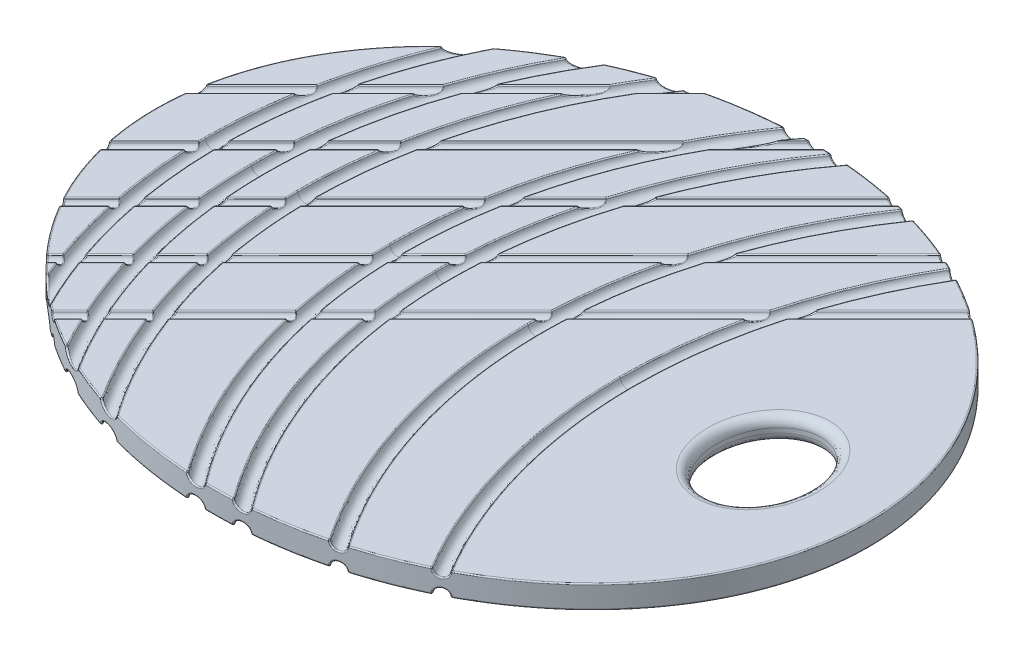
SolidWorks part; units mm, degrees
ref_plane "Front Plane" through (0, 0, 0) normal (0, 0, 1) x (1, 0, 0)
ref_plane "Top Plane" through (0, 0, 0) normal (0, 1, 0) x (1, 0, 0)
ref_plane "Right Plane" through (0, 0, 0) normal (1, 0, 0) x (0, 0, -1)
sketch "Sketch1" plane through (0, 0, 0) normal (0, 1, 0) x (1, 0, 0)
  line L0 (-77.5, 0) -> (77.5, 0) construction
  ellipse E0 centre (0, 0) end of major axis (77.5, 0) minor radius 65
  ellipse E1 centre (54.5, 0) end of major axis (54.5, -12.5) minor radius 10
  point P10 (0, 0)
  dimension "D1" = 155
  dimension "D2" = 130
  dimension "D3" = 25
  dimension "D4" = 20
  dimension "D5" = 13
extrude "Boss-Extrude1" add sketch "Sketch1" along normal blind 2.5 contours L0 E0 E1 | E0 L0 E1
sketch "Sketch4" plane through (0, 2.5, 0) normal (0, 1, 0) x (1, 0, 0)
  line L0 (-35, 75) -> (-35, -75) construction
  line L1 (0, 0) -> (-35, 0) construction
  arc A0 (-35, 75) -> (-35, -75) centre (43.75, 0) ccw
  point P6 (-65, 0)
  dimension "D1" = 35
  dimension "D3" = 30
  dimension "D2" = 150
sketch "Sketch3" plane through (0, 0, 0) normal (0, 0, 1) x (1, 0, 0)
  circle A0 centre (-65, 2.5) radius 1.5
  point P0 (0, 0)
  dimension "D1" = 3
sweep "Cut-Sweep1" cut profiles "Sketch3" path "Sketch4"
mirror "Mirror1" about plane through (0, 0, 0) normal (0, 0, 1) of "Cut-Sweep1"
sketch "Sketch5" plane through (0, 2.5, 0) normal (0, 1, 0) x (1, 0, 0)
  line L0 (-48.4084, 0) -> (95.7734, 0) construction
  line L1 (0, 0) -> (62.7975, 62.7975) construction
  line L2 (92.3498, -64.0656) -> (-46.9591, 75.2433) construction
  point P5 (-51.3269, 70.8754)
  point P8 (94.0535, -62.3619)
  dimension "D1" = 45
  dimension "D2" = 20
pattern_linear "LPattern1" count 10 spacing 10 along (1, 0, 0) of "Mirror1", "Cut-Sweep1"
fillet "Fillet1" [suppressed] radius 1
ref_plane "Plane1" through (62.7975, 2.5, -62.7975) normal (0.7071, 0, -0.7071) x (-0.7071, 0, -0.7071)
sketch "Sketch6" plane through (62.7975, 2.5, -62.7975) normal (0.7071, 0, -0.7071) x (-0.7071, 0, -0.7071)
  line L0 (34.2299, 0) -> (-67.722, 0) construction
  circle A0 centre (0, 0) radius 1
  dimension "D1" = 2
extrude "Cut-Extrude1" cut sketch "Sketch6" against normal through all
pattern_linear "LPattern2" count 5 spacing 15 along (-0.7071, 0, -0.7071) of "Cut-Extrude1"
fillet "Fillet4" radius 0.25 228 edges at (32.4717, 2.5, 59.0194) (7.5604, 2.5, 29.642) (24.1172, 1.0039, 61.7726) (-66.4977, 2.5, 0.7184) (77.2951, 2.5, 4.7238) (26.1041, 2.5, 23.8194) (40.1016, 1.0098, 55.6218) (-7.4361, 2.5, 43.7766) (-15.0828, 1.5003, 15.0456) (-13.0778, 1.5005, 13.1224) (-17.4361, 2.5, 43.7766) (-34.9033, 2.5, 49.218) (-54.7659, 1.0003, 45.9911) (24.2171, 2.5, -12.5541) (36.0699, 2.5, -44.285) (3.505, 2.5, -1.053) (8.3137, 2.5, -19.6402) (45.3552, 2.5, -52.7064) (-45.564, 2.5, 52.5796) (49.8883, 1.5054, -49.742) (30.686, 1.5195, -30.9639) (6.3009, 1.5127, -6.0762) (27.1998, 1.525, -26.8856) (-49.8883, 1.5054, 49.742) (-46.0265, 1.5002, 45.9953) (-44.317, 1.5004, 44.3546) (-38.9655, 1.5002, 38.994) (-37.2234, 1.5005, 37.2675) (-23.5634, 1.5, 23.5537) (3.9507, 1.5116, -4.1651) (-21.6738, 1.5001, 21.6896) (40.3634, 2.5, -41.7776) (40.5773, 2.5, -39.1631) (16.4929, 2.5, -15.0787) (17.0615, 2.5, -18.4757) (-47.4101, 2.5, 48.8243) (-48.6878, 2.5, 47.2736) (-41.2359, 2.5, 42.6501) (-42.0653, 2.5, 40.6511) (-30.087, 2.5, 31.5012) (-30.7233, 2.5, 29.3091) (-4.6346, 2.5, 3.2204) (-4.531, 2.5, 5.9452) (-18.1718, 2.5, 19.586) (-18.5854, 2.5, 17.1712) (-25.4799, 2.5, 14.9594) (-26.0131, 1.5, 4.7914) (-23.849, 1.5001, 2.6532) (-45.4799, 2.5, 14.9594) (-42.4396, 2.5, 29.642) (-46.0581, 1.5, 3.62) (-43.8283, 1.5444, 1.8186) (-55.0327, 2.5, 17.926) (-50.6693, 2.5, 35.3769) (18.1513, 2.5, -48.6154) (4.6471, 2.5, -15.8625) (-70.073, 2.5, -27.7665) (-15.1298, 2.5, -17.3278) (-16.4873, 2.5, -1.6751) (-11.3849, 2.5, -21.1947) (-0.4243, 2.5, -51.3202) (-21.5847, 2.5, -32.5525) (-26.2214, 2.5, -7.8323) (-16.5391, 2.5, -38.0085) (-3.4924, 2.5, -62.3805) (-16.084, 1.873, -46.454) (-6.1833, 1.943, -58.6309) (-40.9729, 2.5, -34.4701) (-46.1678, 2.5, -8.5518) (-42.9754, 2.5, -10.5953) (-35.6354, 2.5, -40.3125) (-28.1105, 1.9734, -55.5401) (-33.9984, 1.5784, -50.3053) (-54.6069, 2.5, -20.3432) (-56.4607, 2.5, -2.9423) (-50.684, 2.5, -24.4153) (-41.5734, 2.5, -49.153) (-66.2471, 2.5, -7.4535) (-64.2049, 1.2281, 0) (-65.7911, 2.5, 12.4823) (-61.1543, 2.5, -33.9114) (-62.263, 2.5, 30.2707) (-58.3952, 2.5, 41.4901) (-59.8282, 2.5, 27.8228) (-63.0584, 2.5, 9.7228) (-54.7018, 1.0013, -46.0448) (-77.4423, 2.5, 2.5071) (-73.6279, 2.5, 20.2889) (-66.016, 2.5, 34.0493) (-59.0235, 2.5, 42.1236) (-0.8113, 2.5, -64.9964) (13.6913, 2.5, -63.9776) (30.5717, 2.5, -59.729) (-76.0664, 1.5001, 12.4443) (-66.0978, 1.5048, 2.3204) (-63.7343, 1.6888, 0.9217) (-63.605, 1.932, -1.1986) (-55.8368, 1.5011, -7.87) (-53.4, 1.5016, -10.1596) (-44.4192, 1.5002, -19.2469) (1.4163, 1.5011, -64.9891) (-41.6137, 1.5006, -21.9776) (-71.1065, 2.5, 8.8811) (-71.4082, 2.5, 6.3544) (-59.9177, 2.5, -2.3077) (-59.8137, 2.5, -5.2401) (-49.1427, 2.5, -13.0827) (-48.6901, 2.5, -16.3637) (-2.6952, 2.5, -62.3587) (-3.5483, 2.5, -58.6771) (-29.0515, 2.5, -33.1739) (-27.3141, 2.5, -37.7397) (-70.1603, 1.5038, 27.611) (-63.9953, 1.5012, 21.4983) (20.2801, 1.5002, -62.7351) (-8.2624, 1.5053, -34.309) (-21.8425, 1.5117, -20.7999) (-11.6384, 1.5355, -31.1615) (-62.0604, 1.5015, 19.7106) (-55.3592, 1.5005, 12.8879) (-24.64, 1.5202, -18.0694) (-43.5431, 2.142, -0.2038) (-53.3221, 1.5007, 10.9485) (-66.8323, 2.5, 25.8201) (-67.5788, 2.5, 23.7382) (6.0929, 2.5, -49.9335) (6.5087, 2.5, -47.5209) (-17.2986, 2.5, -23.7136) (-16.3833, 2.5, -27.4573) (-58.5296, 2.5, 17.5174) (-58.9012, 2.5, 15.0606) (-34.176, 2.5, -9.6646) (-34.4294, 2.5, -6.5828) (-49.6068, 2.5, 8.5947) (-49.7836, 2.5, 5.943) (-76.8882, 1.5087, -8.1513) (-64.1251, 1.5037, -20.8485) (-61.3001, 1.505, -23.4113) (-50.9609, 1.5564, -33.4238) (-46.6949, 1.543, -38.568) (-71.0354, 2.5, -12.4032) (-70.4665, 2.5, -15.8005) (-56.5251, 2.5, -26.9135) (-55.4337, 2.5, -30.8333) (-41.375, 2.5, -42.0636) (-38.958, 2.5, -47.309) (-24.4911, 2.5, -58.9475) (-21.307, 1.8306, -62.4952) (-61.2266, 1.5067, 39.8503) (-59.316, 1.5005, 38.059) (-13.6162, 1.5181, -7.3293) (7.6485, 1.5192, -28.586) (36.3001, 1.5018, -57.429) (11.2042, 1.5141, -32.6544) (-57.5462, 1.5006, 36.3815) (-51.7774, 1.5, 30.5736) (-49.9696, 1.5, 28.7523) (-43.7784, 1.5, 22.5525) (-15.9963, 1.5167, -5.4745) (-41.8761, 1.5001, 20.6819) (-59.8379, 2.5, 40.0389) (-60.9018, 2.5, 38.2743) (-3.2803, 2.5, -16.5187) (-2.6495, 2.5, -19.9779) (23.8141, 2.5, -46.4415) (24.1205, 2.5, -43.9195) (-54.3239, 2.5, 34.5249) (-55.0152, 2.5, 32.3878) (-46.5967, 2.5, 26.7977) (-47.1495, 2.5, 24.5221) (-19.9079, 2.5, -2.7195) (-19.9435, 2.5, 0.1445) (-47.2178, 2.5, -51.543) (-33.813, 2.5, 14.014) (-34.1053, 2.5, 11.4779) (-39.3493, 1.0038, -55.9984) (-46.7345, 2.5, -45.3643) (-53.403, 2.5, -4.5608) (-32.801, 2.5, -58.8912) (-27.7835, 1.4485, -60.6795) (-30.5302, 2.5, -57.1515) (-13.191, 2.5, -64.0516) (-3.3565, 1.0034, -64.939) (-9.925, 2.5, -58.1383) (-23.0635, 2.5, -9.6667) (3.6749, 2.5, -64.9269) (6.3563, 1.0004, -64.781) (-4.9196, 2.5, -49.1872) (-13.4508, 2.5, -3.2494) (22.0695, 2.5, -62.3088) (24.333, 1.0036, -61.7131) (13.9608, 2.5, -46.8741) (6.5317, 2.5, -2.607) (38.0652, 2.5, -56.6194) (40.4068, 1.0097, -55.4662) (32.173, 2.5, -42.8622) (27.5115, 2.5, -14.6949) (-32.8009, 2.5, 58.8912) (-56.459, 2.5, 2.9999) (-39.4665, 1.0004, 55.9404) (-14.7556, 2.5, 63.811) (-25.8669, 1.0119, 61.2726) (1.5252, 2.5, 64.9874) (-3.4641, 1.0001, 64.935) (15.4993, 2.5, 63.6869) (-51.367, 2.5, 48.6718) (-16.459, 2.5, 2.9999) (6.4344, 1.0003, 64.7756) (-54.6459, 2.5, 42.6709)
mirror "Mirror2" about plane through (0, 0, 0) normal (0, 1, 0)
fillet "Fillet3" radius 2 2 edges at (54.5, -2.5, 12.5) (54.5, 2.5, 12.5)
